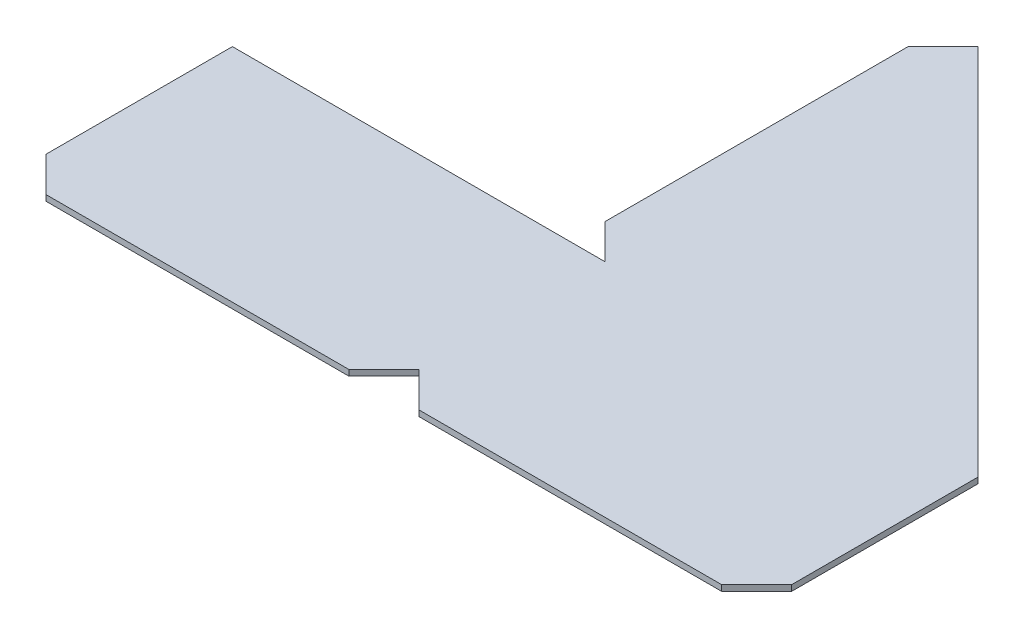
SolidWorks part; units mm, degrees
ref_plane "Front Plane" through (0, 0, 0) normal (0, 0, 1) x (1, 0, 0)
ref_plane "Top Plane" through (0, 0, 0) normal (0, 1, 0) x (1, 0, 0)
ref_plane "Right Plane" through (0, 0, 0) normal (1, 0, 0) x (0, 0, -1)
sketch "Sketch1" plane through (0, 0, 0) normal (0, 1, 0) x (1, 0, 0)
  line L0 (0, 0) -> (52, 0)
  line L1 (52, 0) -> (58, 6)
  line L2 (58, 6) -> (64, 0)
  line L3 (64, 0) -> (116, 0)
  line L4 (116, 0) -> (122, 6)
  line L5 (122, 6) -> (122, 38)
  line L6 (122, 38) -> (58, 102)
  line L7 (58, 102) -> (52, 96)
  line L8 (52, 96) -> (52, 44)
  line L9 (52, 44) -> (58, 38)
  line L10 (58, 38) -> (-6, 38)
  line L11 (-6, 38) -> (-6, 6)
  line L12 (-6, 6) -> (0, 0)
  line L13 (122, 38) -> (58, 38) construction
  line L14 (58, 6) -> (58, 38) construction
  line L15 (122, 6) -> (58, 6) construction
  line L16 (58, 102) -> (58, 38) construction
  line L17 (58, 6) -> (-6, 6) construction
  dimension "D1" = 6
  dimension "D2" = 6
  dimension "D3" = 64
  dimension "D4" = 32
  dimension "D5" = 45
  dimension "D6" = 45
  dimension "D7" = 45
  dimension "D9" = 45
  dimension "D10" = 45
  dimension "D12" = 64
sheet metal parameters "Sheet-Metal1" thickness 1 parameters "D1"=1
base flange "Base-Flange1" sketch "Sketch1" thickness 1 reverse thickness direction yes parameters "D1"=1
flat pattern "Flat-Pattern1"
sketch "Bend-Lines1" plane through (0, 0, 0) normal (0, 1, 0) x (-1, 0, 0)
